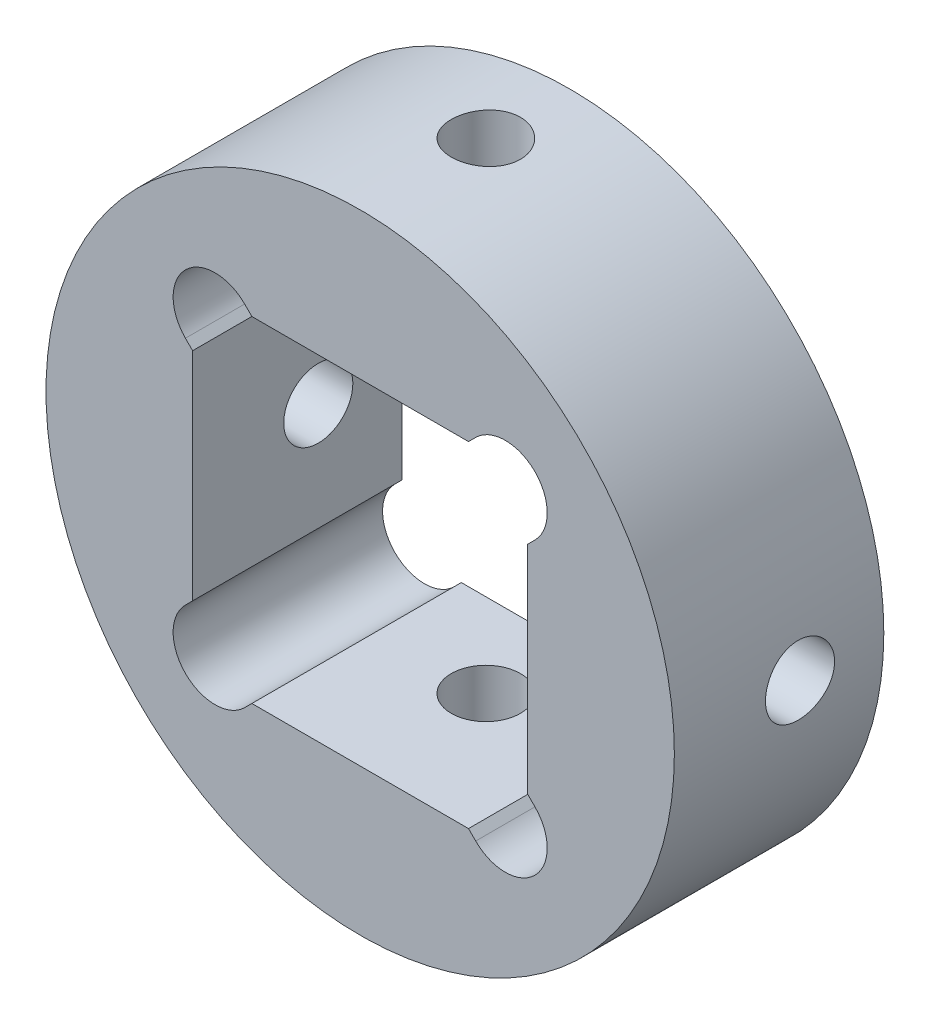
SolidWorks part; units mm, degrees
ref_plane "Plan de face" through (0, 0, 0) normal (0, 0, 1) x (1, 0, 0)
ref_plane "Plan de dessus" through (0, 0, 0) normal (0, 1, 0) x (1, 0, 0)
ref_plane "Plan de droite" through (0, 0, 0) normal (1, 0, 0) x (0, 0, -1)
sketch "Esquisse1" plane through (0, 0, 0) normal (0, 0, 1) x (1, 0, 0)
  line L0 (0, 0) -> (6.9296, 6.9296) construction
  line L1 (-8, 5.1716) -> (-8, -5.1716)
  line L2 (-5.1716, -8) -> (5.1716, -8)
  line L4 (8.3439, -5.5154) -> (8, -5.1716)
  line L5 (8, 5.8593) -> (3.9604, 9.8989) construction
  line L6 (5.5154, 8.3439) -> (5.1716, 8)
  line L7 (8.3439, 5.5154) -> (8, 5.1716)
  line L8 (8, 5.1716) -> (8, -5.1716)
  line L9 (5.5154, -8.3439) -> (5.1716, -8)
  line L10 (5.8593, -8) -> (9.8989, -3.9604) construction
  line L11 (-5.5154, -8.3439) -> (-5.1716, -8)
  line L12 (-8.3439, -5.5154) -> (-8, -5.1716)
  line L13 (-8, -5.8593) -> (-3.9604, -9.8989) construction
  line L14 (-8.3439, 5.5154) -> (-8, 5.1716)
  line L15 (-5.5154, 8.3439) -> (-5.1716, 8)
  line L16 (-5.8593, 8) -> (-9.8989, 3.9604) construction
  line L17 (-5.1716, 8) -> (5.1716, 8)
  arc A0 (8.3439, 5.5154) -> (5.5154, 8.3439) centre (6.9296, 6.9296) ccw
  arc A1 (5.5154, -8.3439) -> (8.3439, -5.5154) centre (6.9296, -6.9296) ccw
  arc A2 (-8.3439, -5.5154) -> (-5.5154, -8.3439) centre (-6.9296, -6.9296) ccw
  arc A3 (-5.5154, 8.3439) -> (-8.3439, 5.5154) centre (-6.9296, 6.9296) ccw
  circle A4 centre (0, 0) radius 15
  point P0 (-8, 8)
  point P1 (8, -8)
  point P2 (-8, -8)
  point P3 (8, 8)
  point P4 (-15, 15)
  point P6 (15, 15)
  point P7 (15, -15)
  point P8 (-15, -15)
  point P10 (0, 0)
  dimension "D6" = 4
  dimension "D1" = 4
  dimension "D5" = 9.8
extrude "Boss.-Extru.1" add sketch "Esquisse1" along normal blind 10 from offset 4
hole_wizard "Trou taraudé M41" positions "Esquisse4" profile "Esquisse3" tap size "M4" standard "ISO"
sketch "Esquisse4" plane through (0, -8, 0) normal (0, 1, 0) x (-1, 0, 0)
  point P0 (0, 0)
sketch "Esquisse3" plane through (0, -8, 0) normal (1, 0, 0) x (0, 0, 1)
  line L0 (0, 0) -> (0, 7)
  line L1 (0, 7) -> (1.65, 7)
  line L2 (1.65, 7) -> (1.65, 0)
  line L5 (1.65, 0) -> (0, 0)
  line L11 (0, -6.35) -> (0, 107.95) construction
  dimension "Diamètre du trou pour taraudage jusqu'au prochain" = 3.3
  dimension "Profondeur du trou pour taraudage jusqu'au prochain" = 7
pattern_circular "Répétition circulaire1" count 4 over 360 about axis through (0, 0, 6) along (0, 0, -1) of "Trou taraudé M41"
